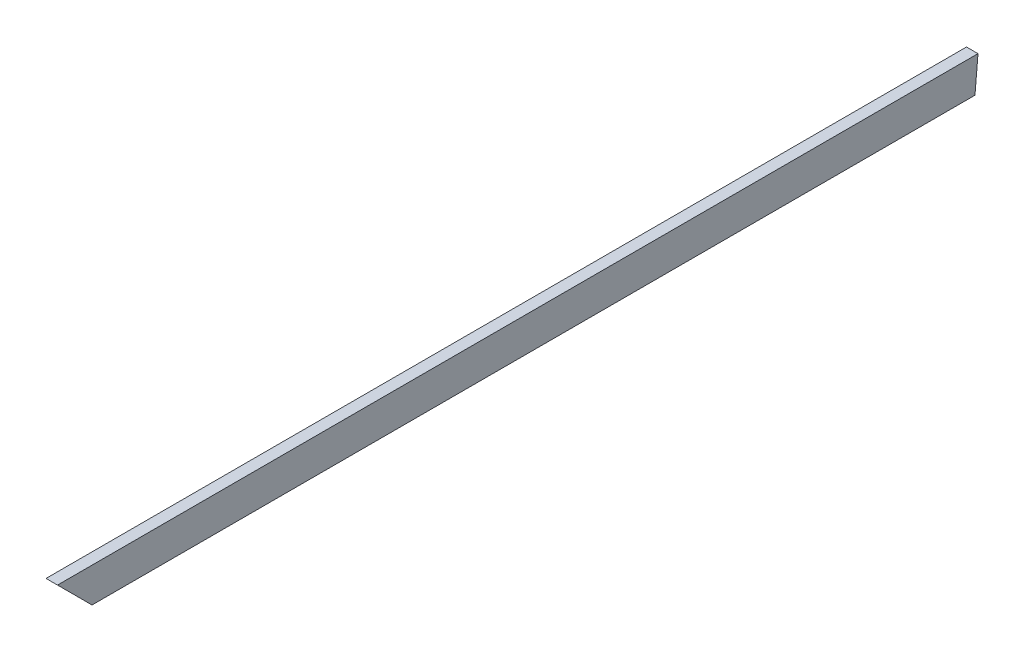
SolidWorks part; units mm, degrees
ref_plane "Vorne" through (0, 0, 0) normal (0, 0, 1) x (1, 0, 0)
ref_plane "Oben" through (0, 0, 0) normal (0, 1, 0) x (1, 0, 0)
ref_plane "Rechts" through (0, 0, 0) normal (1, 0, 0) x (0, 0, -1)
sketch "Skizze1" plane through (0, 0, 0) normal (0, 0, 1) x (1, 0, 0)
  line L1 (0, 0) -> (50, 0)
  line L2 (0, 0) -> (0, 150)
  line L3 (0, 150) -> (50, 150)
  line L4 (50, 0) -> (50, 150)
  dimension "D1" = 50
  dimension "D2" = 150
extrude "Aufsatz-Linear austragen1" add sketch "Skizze1" along normal mid plane 4000
shell "Wandung1" thickness 4
sketch "Skizze2" plane through (50, 0, 0) normal (1, 0, 0) x (0, 0, -1)
  line L0 (-2000, 150) -> (-2000, 0)
  line L1 (-2000, 0) -> (-1850, 0)
  line L2 (-2000, 0) -> (2000, 0) construction
  line L3 (-1850, 0) -> (-2000, 150)
  line L4 (2000, 0) -> (1986.8767, 0)
  line L5 (1986.8767, 0) -> (2000, 150)
  line L6 (2000, 150) -> (2000, 0)
  dimension "D1" = 45
  dimension "D2" = 5
extrude "Schnitt-Linear austragen1" cut sketch "Skizze2" against normal through all
